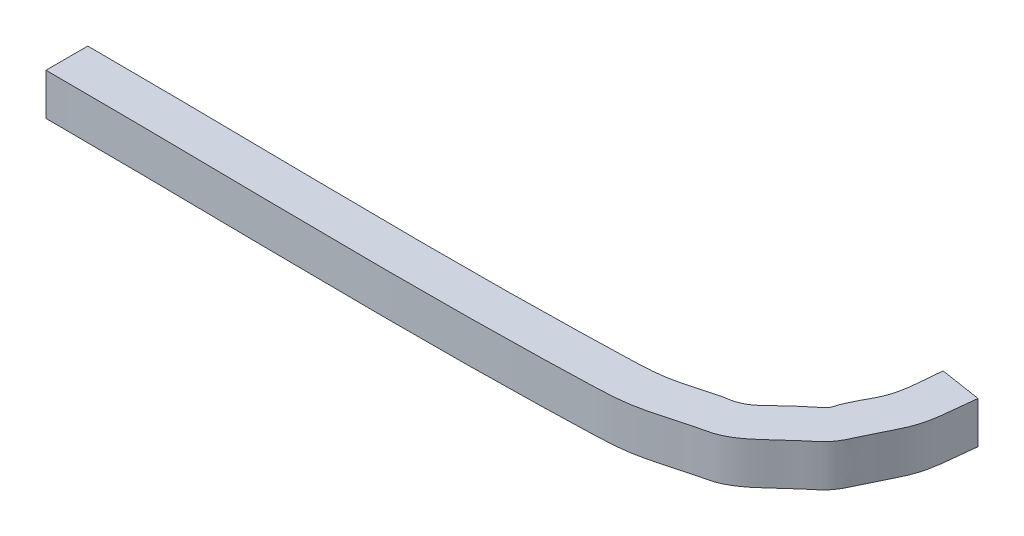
SolidWorks part; units mm, degrees
ref_plane "Ebene vorne" through (0, 0, 0) normal (0, 0, 1) x (1, 0, 0)
ref_plane "Ebene oben" through (0, 0, 0) normal (0, 1, 0) x (1, 0, 0)
ref_plane "Ebene rechts" through (0, 0, 0) normal (1, 0, 0) x (0, 0, -1)
sketch "Sketch1" plane through (0, 0, 0) normal (0, 1, 0) x (1, 0, 0)
  line L0 (0, 0) -> (68.7206, 0) construction
  line L1 (68.7206, 0) -> (80.7372, 2.9485) construction
  line L2 (80.7372, 2.9485) -> (89.071, 9.8417) construction
  line L3 (89.071, 9.8417) -> (93.4415, 18.0332) construction
  line L4 (93.4415, 18.0332) -> (94.6816, 25.961) construction
  spline S0 degree 3 poles (0, 0) (21.8443, 0) (45.1013, -0.842) (71.1199, 0.2174) (75.6702, 1.7387) (79.5908, 2.6585) (82.9659, 4.2753) (85.5115, 6.9496) (88.2739, 9.1698) (90.3577, 11.633) (91.8422, 14.9626) (94.2635, 19.956) (94.2987, 23.5133) (94.6816, 25.961) knots 0 0 0 0 0.601923 0.639639 0.715184 0.732568 0.750286 0.817218 0.832364 0.847726 0.905413 0.931734 1 1 1 1
sketch "Sketch2" plane through (0, 0, 0) normal (1, 0, 0) x (0, 0, -1)
  line L1 (5, 0) -> (10, 0)
  line L2 (5, 0) -> (5, 5)
  line L3 (5, 5) -> (10, 5)
  line L4 (10, 0) -> (10, 5)
  dimension "D1" = 5
  dimension "D2" = 5
sketch "Sketch3" plane through (0, 0, 0) normal (0, 1, 0) x (1, 0, 0)
  spline S0 degree 3 poles (-437.2887, -899.3168) (-280.2442, 86.7122) (-106.3062, -7.0068) (71.1199, 0.2174) (75.6702, 1.7387) (79.5908, 2.6585) (82.9659, 4.2753) (85.5115, 6.9496) (88.2739, 9.1698) (90.3577, 11.633) (91.8422, 14.9626) (104.2337, 40.5173) (30.2195, 90.695) (1065.5294, -213.5395) knots -4.161808 -4.161808 -4.161808 -4.161808 0.601923 0.639639 0.715184 0.732568 0.750286 0.817218 0.832364 0.847726 0.905413 0.931734 1.627016 1.627016 1.627016 1.627016 only from (0, 0) to (94.6816, 25.961) construction
  spline S1 degree 3 poles (0, 0) (21.8443, 0) (45.1013, -0.842) (71.1199, 0.2174) (75.6702, 1.7387) (79.5908, 2.6585) (82.9659, 4.2753) (85.5115, 6.9496) (88.2739, 9.1698) (90.3577, 11.633) (91.8422, 14.9626) (94.2635, 19.956) (94.2987, 23.5133) (94.6816, 25.961) knots 0 0 0 0 0.601923 0.639639 0.715184 0.732568 0.750286 0.817218 0.832364 0.847726 0.905413 0.931734 1 1 1 1
sweep "Sweep5" add profiles "Sketch2" path "Sketch3"
